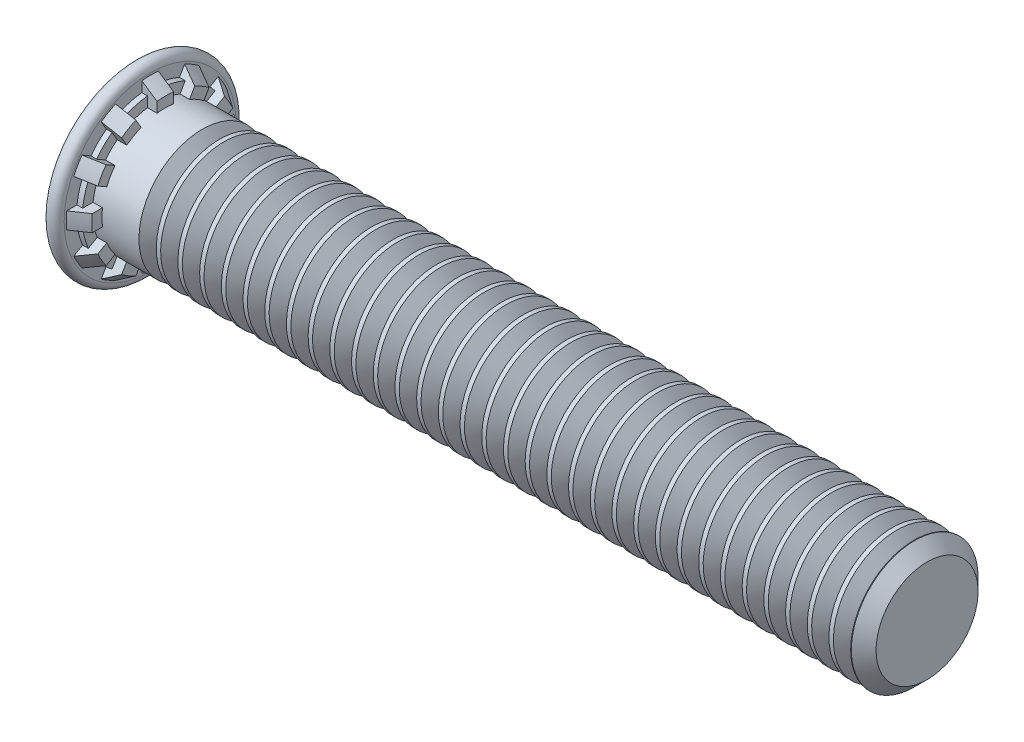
SolidWorks part; units mm, degrees
ref_plane "Plane1" through (0, 0, 0) normal (0, 0, 1) x (1, 0, 0)
ref_plane "Plane2" through (0, 0, 0) normal (0, 1, 0) x (1, 0, 0)
ref_plane "Plane3" through (0, 0, 0) normal (1, 0, 0) x (0, 0, -1)
revolve "BaseBody" add sketch "BodySke" angle 360 about L6
sketch "BodySke" plane through (0, 0, 0) normal (0, 0, 1) x (1, 0, 0)
  line L0 (0, 0) -> (0, 2.7075)
  line L1 (0.48, 2.7125) -> (0.48, 2.645)
  line L2 (0.48, 2.645) -> (0.96, 2.3225)
  line L3 (0.96, 2) -> (24.61, 2)
  line L4 (25, 1.61) -> (25, 0)
  line L5 (25, 0) -> (0, 0)
  line L6 (0, 0) -> (50.554, 0) construction
  line L7 (0.96, 2.3225) -> (0.96, 2)
  line L8 (25, 1.61) -> (24.61, 2)
  line L9 (-9.525, 2.95) -> (9.525, 2.95) construction
  line L11 (1.66, 19.05) -> (1.66, -3.175) construction
  line L13 (9.525, -2.95) -> (-9.525, -2.95) construction
  line L14 (0.0051, 2.7125) -> (0.0051, 2.7075)
  line L15 (0, 2.7075) -> (0.0051, 2.7075)
  arc A0 (0.0051, 2.7125) -> (0.48, 2.7125) centre (0.2425, 2.7125) cw
  dimension "D2" = 0.0051
  dimension "D1" = 0.0051
  dimension "Diameter" = 4
  dimension "Length" = 25
  dimension "Body_ch_ang" = 45
  dimension "Minor_dia" = 3.22
  dimension "Advance" = 0.7
  dimension "H_dia" = 5.9
  dimension "Shoulder_lower_dia" = 5.29
  dimension "Shoulder_upper_dia" = 4.645
  dimension "Shoulder_ht" = 0.96
  dimension "T_dim" = 0.48
sketch "ThdSchSke" plane through (0, 0, 0) normal (0, 0, 1) x (1, 0, 0)
  line L0 (2.4, -1.61) -> (2.1269, -2)
  line L1 (2.4, -1.61) -> (2.6731, -2)
  line L2 (2.6731, -2) -> (2.6731, -2.5)
  line L3 (-3.175, 0) -> (5.1513, 0) construction
  line L5 (2.6731, -2.5) -> (2.1269, -2.5)
  line L6 (2.1269, -2.5) -> (2.1269, -2)
  line L7 (0, 2.7075) -> (0, -2.7075) construction
  dimension "Thread_minor" = 3.22
  dimension "Diameter" = 4
  dimension "Start" = 2.4
  dimension "SideAngle" = 55
  dimension "VeeAngle" = 70
  dimension "Overcut" = 5
revolve "ThreadSchematic" cut sketch "ThdSchSke" angle 360 about L3
pattern_linear "ThdSchPat" count 33 spacing 0.6848 along (1, 0, 0) of "ThreadSchematic"
sketch "RibCut1Ske" plane through (0.96, 0, 0) normal (1, 0, 0) x (0, 0, -1)
  line L0 (0.2611, 1.9829) -> (0.2611, 2.9384)
  line L1 (0.7654, 1.8478) -> (1.2431, 2.6753)
  line L2 (0, 0) -> (0, 4.9784) construction
  line L3 (0, 0) -> (0.2611, 1.9829) construction
  line L4 (0, 0) -> (0.7654, 1.8478) construction
  arc A1 (0.7654, 1.8478) -> (0.2611, 1.9829) centre (0, 0) ccw
  arc A2 (1.2431, 2.6753) -> (0.2611, 2.9384) centre (0, 0) ccw
  dimension "Inner_dia" = 4
  dimension "Outer_dia" = 5.9
  dimension "Rib_root_half_angle" = 7.5
  dimension "Rib_root_gap_angle" = 15
  dimension "Angle" = 30
extrude "RibCut1" cut sketch "RibCut1Ske" against normal blind 0.3
sketch "RibCut2Ske" plane through (0.96, 0, 0) normal (1, 0, 0) x (0, 0, -1)
  line L0 (0.2611, 2.3078) -> (0.2611, 2.9384)
  line L1 (0.9278, 2.1291) -> (1.2431, 2.6753)
  line L2 (0.2611, 1.9829) -> (0.2611, 3.7946) construction
  line L3 (0, 0) -> (0, 5.0239) construction
  line L4 (0, 0) -> (0.2611, 1.9829) construction
  line L5 (0, 0) -> (0.7654, 1.8478) construction
  line L6 (0.7654, 1.8478) -> (1.6748, 3.4229) construction
  arc A1 (0.9278, 2.1291) -> (0.2611, 2.3078) centre (0, 0) ccw
  arc A2 (1.2431, 2.6753) -> (0.2611, 2.9384) centre (0, 0) ccw
  circle A4 centre (0, 0) radius 2 construction
  dimension "Inner_dia" = 4.645
  dimension "Outer_dia" = 5.9
  dimension "Rib_root_dia" = 4
  dimension "Rib_root_half_angle" = 7.5
  dimension "Rib_root_gap_angle" = 15
  dimension "Angle" = 30
extrude "RibCut2" cut sketch "RibCut2Ske" against normal blind 0.48
pattern_circular "RibCutsPat" count 12 every 30 about axis through (0, 0, 0) along (1, 0, 0) of "RibCut2", "RibCut1"
equation "' \"Length@BodySke\" = 18"
equation "' \"H_dia@BodySke\" = 8.2"
equation "' \"Start@ThdSchSke\" = 3"
equation "' \"Diameter@BodySke\" = 6"
equation "' \"Minor_dia@BodySke\" = 4.819"
equation "' \"Advance@BodySke\" = 1"
equation "\"T_dim@BodySke\" = \"Start@ThdSchSke\" * 0.2"
equation "\"Shoulder_ht@BodySke\" = \"Start@ThdSchSke\" * 0.4"
equation "\"Shoulder_lower_dia@BodySke\" = \"H_dia@BodySke\" - \"Start@ThdSchSke\" * 0.2 - .13"
equation "\"Shoulder_upper_dia@BodySke\" = ( \"Shoulder_lower_dia@BodySke\" + \"Diameter@BodySke\" ) /2"
equation "\"Num_ribs@RibCutsPat\" = 12"
equation "\"Angle@RibCutsPat\" = 360 / \"Num_ribs@RibCutsPat\""
equation "\"Angle@RibCut1Ske\" =\"Angle@RibCutsPat\""
equation "\"Rib_root_half_angle@RibCut1Ske\" = \"Angle@RibCut1Ske\" / 4"
equation "\"Rib_root_gap_angle@RibCut1Ske\" = \"Angle@RibCut1Ske\" - (2 * \"Rib_root_half_angle@RibCut1Ske\" )"
equation "\"Inner_dia@RibCut1Ske\" = \"Diameter@BodySke\""
equation "\"Outer_dia@RibCut1Ske\" = \"H_dia@BodySke\""
equation "\"Depth@RibCut1\" =  \"Start@ThdSchSke\" * 0.125"
equation "\"Angle@RibCut2Ske\" =\"Angle@RibCutsPat\""
equation "\"Rib_root_half_angle@RibCut2Ske\" = \"Angle@RibCut1Ske\" / 4"
equation "\"Rib_root_gap_angle@RibCut2Ske\" = \"Angle@RibCut1Ske\" - (2 * \"Rib_root_half_angle@RibCut1Ske\" )"
equation "\"Rib_root_dia@RibCut2Ske\" = \"Diameter@BodySke\""
equation "\"Inner_dia@RibCut2Ske\" = \"Shoulder_upper_dia@BodySke\""
equation "\"Outer_dia@RibCut2Ske\" = \"H_dia@BodySke\""
equation "\"Depth@RibCut2\" =  \"Start@ThdSchSke\" * 0.2"
equation "\"Thread_length@ThreadCosmetic\" = \"Length@BodySke\" - \"Start@ThdSchSke\""
equation "\"Thread_minor@ThreadCosmetic\" = \"Minor_dia@BodySke\""
equation "\"Thread_minor@ThdSchSke\" = \"Minor_dia@BodySke\""
equation "\"Diameter@ThdSchSke\" = \"Diameter@BodySke\""
equation "\"Overcut@ThdSchSke\" = \"Diameter@BodySke\" * 1.25"
equation "\"Num_threads@ThdSchPat\" = int( \"Thread_length@ThreadCosmetic\" / \"Advance@BodySke\" + 0.999 )  + 1"
equation "\"Advance@ThdSchPat\" = \"Thread_length@ThreadCosmetic\" /  (\"Num_threads@ThdSchPat\" - 1) 'relax it"
equation "\"Num_threads@ThdSchPat\" = \"Num_threads@ThdSchPat\" - sgn( \"Num_threads@ThdSchPat\" - 1) '---chamfered tips only---"
